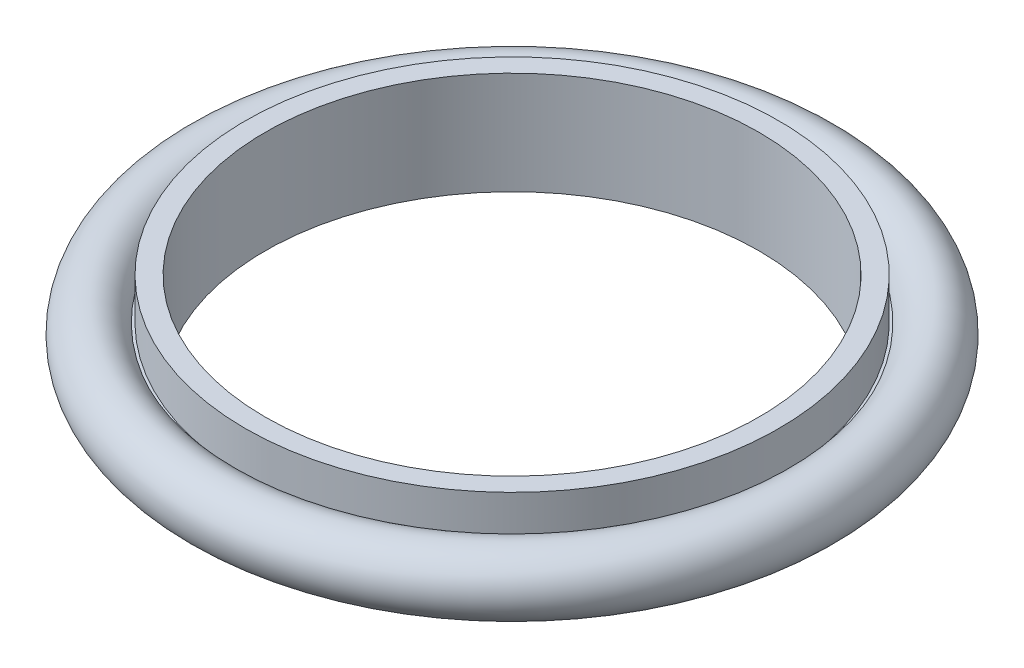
SolidWorks part; units mm, degrees
ref_plane "Front Plane" through (0, 0, 0) normal (0, 0, 1) x (1, 0, 0)
ref_plane "Top Plane" through (0, 0, 0) normal (0, 1, 0) x (1, 0, 0)
ref_plane "Right Plane" through (0, 0, 0) normal (1, 0, 0) x (0, 0, -1)
sketch "Sketch1" plane through (0, 0, 0) normal (1, 0, 0) x (0, 0, -1)
  line L0 (0, 0) -> (0, -92.4737) construction
  line L1 (20.447, 3.3794) -> (20.447, 0)
  line L2 (18.923, 7.874) -> (20.447, 7.874)
  line L3 (18.923, 7.874) -> (18.923, 0)
  line L4 (18.923, 0) -> (20.447, 0)
  line L5 (20.447, 7.874) -> (20.447, 4.6873)
  line L6 (20.447, 4.6873) -> (20.6448, 4.6873)
  line L8 (20.447, 3.3794) -> (20.5896, 3.3794)
  arc A0 (20.5896, 3.3794) -> (20.6448, 4.6873) centre (22.8981, 3.937) ccw
  dimension "D4" = 4.7498
  dimension "D5" = 3.937
  dimension "D1" = 1.524
  dimension "D2" = 7.874
  dimension "D3" = 20.447
  dimension "D6" = 6.35
revolve "Revolve1" add sketch "Sketch1" angle 360 about L0
